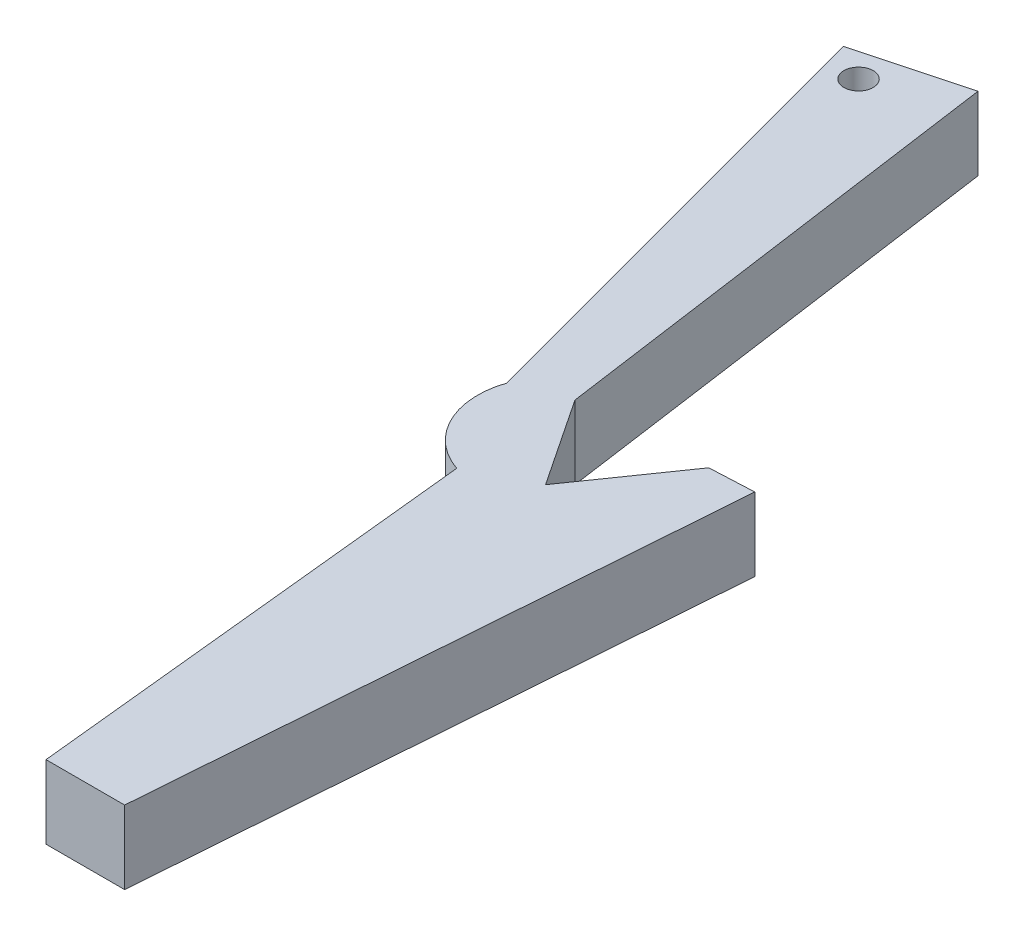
SolidWorks part; units mm, degrees
ref_plane "Front Plane" through (0, 0, 0) normal (0, 0, 1) x (1, 0, 0)
ref_plane "Top Plane" through (0, 0, 0) normal (0, 1, 0) x (1, 0, 0)
ref_plane "Right Plane" through (0, 0, 0) normal (1, 0, 0) x (0, 0, -1)
sketch "Sketch2" plane through (0, 0, 0) normal (0, 1, 0) x (1, 0, 0)
  line L0 (-47.1503, 43.763) -> (48.5052, 43.763) construction
  line L1 (37.5158, 43.763) -> (23.0269, 39.8807)
  line L2 (23.0269, 39.8807) -> (39.8502, -22.9044)
  line L3 (37.5158, 43.763) -> (46.5104, -20.237)
  line L4 (46.5104, -20.237) -> (54.5104, -32.2482)
  line L5 (54.5104, -32.2482) -> (63.6493, -19.115)
  line L6 (63.6493, -19.115) -> (69.6493, -18.8309)
  line L7 (69.6493, -18.8309) -> (63.6493, -98.8309)
  line L8 (63.6493, -98.8309) -> (52.9156, -98.8309)
  line L9 (52.9156, -98.8309) -> (46.5104, -36.3757)
  arc A0 (39.8502, -22.9044) -> (46.5104, -36.3757) centre (49.9159, -26.3099) ccw
  dimension "D1" = 15
  dimension "D2" = 15
  dimension "D3" = 65
  dimension "D4" = 83
  dimension "D5" = 64
  dimension "D6" = 80
  dimension "D7" = 8
  dimension "D8" = 16
  dimension "D9" = 6
  dimension "D10" = 83
extrude "Boss-Extrude1" add sketch "Sketch2" along normal blind 10
sketch "Sketch3" plane through (0, 10, 0) normal (0, 1, 0) x (1, 0, 0)
  line L0 (23.0269, 39.8807) -> (39.8502, -22.9044) construction
  line L1 (37.5158, 43.763) -> (23.0269, 39.8807) construction
  circle A0 centre (27.9259, 37.0523) radius 2
  dimension "D1" = 4
  dimension "D2" = 4
  dimension "D3" = 4
extrude "Cut-Extrude1" cut sketch "Sketch3" against normal through all
